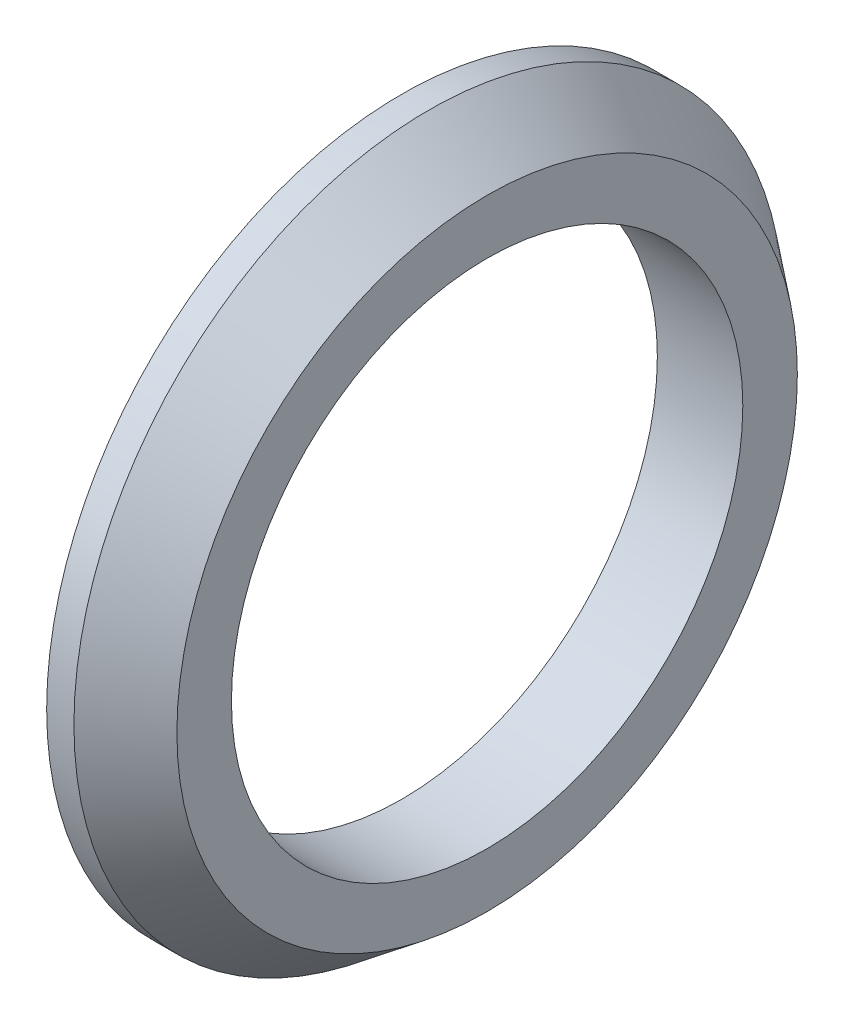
SolidWorks part; units mm, degrees
ref_plane "Front Plane" through (0, 0, 0) normal (0, 0, 1) x (1, 0, 0)
ref_plane "Top Plane" through (0, 0, 0) normal (0, 1, 0) x (1, 0, 0)
ref_plane "Right Plane" through (0, 0, 0) normal (1, 0, 0) x (0, 0, -1)
sketch "Sketch1" plane through (0, 0, 0) normal (0, 0, 1) x (1, 0, 0)
  line L0 (0, 0) -> (13.704, 0) construction
  line L1 (0, 14.2875) -> (4.7752, 14.2875)
  line L2 (4.7752, 14.2875) -> (4.7752, 17.3355)
  line L3 (4.7752, 17.3355) -> (1.524, 19.8374)
  line L4 (1.524, 19.8374) -> (0, 19.8374)
  line L5 (0, 19.8374) -> (0, 14.2875)
  dimension "D1" = 28.575
  dimension "D2" = 39.6748
  dimension "D3" = 3.048
  dimension "D4" = 1.524
  dimension "D5" = 4.7752
revolve "Revolve1" add sketch "Sketch1" angle 360 about L0
